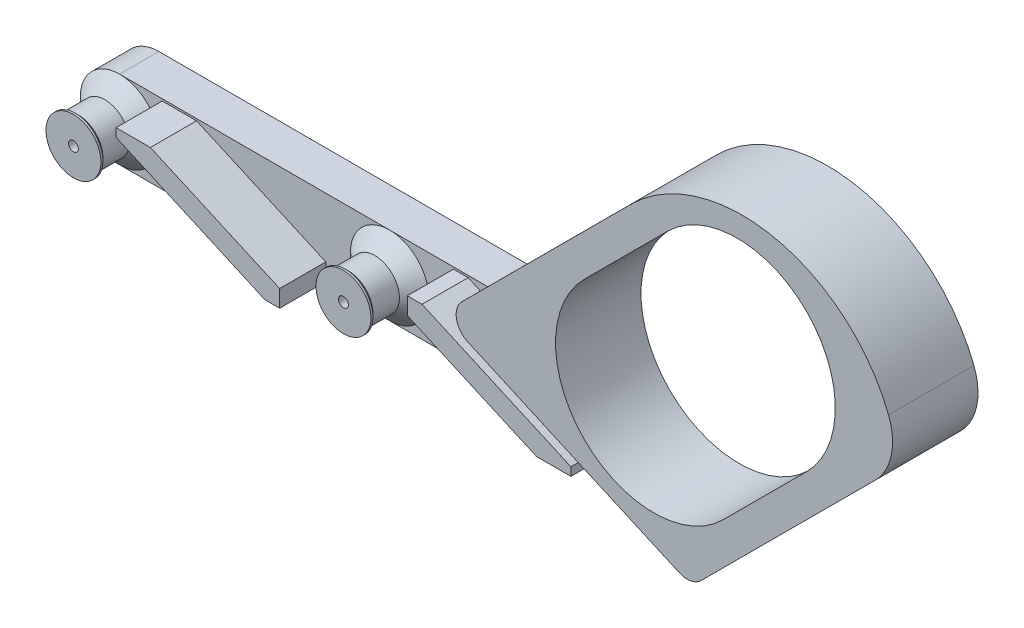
SolidWorks part; units mm, degrees
ref_plane "Alzado" through (0, 0, 0) normal (0, 0, 1) x (1, 0, 0)
ref_plane "Planta" through (0, 0, 0) normal (0, 1, 0) x (1, 0, 0)
ref_plane "Vista lateral" through (0, 0, 0) normal (1, 0, 0) x (0, 0, -1)
sketch "Sketch1" plane through (0, 0, 0) normal (0, 0, 1) x (1, 0, 0)
  line L0 (-27.5, 0) -> (27.5, 0) construction
  line L1 (-27.5, 4) -> (27.5, 4)
  line L2 (-27.5, -4) -> (27.5, -4)
  arc A0 (-27.5, 4) -> (-27.5, -4) centre (-27.5, 0) ccw
  arc A1 (27.5, -4) -> (27.5, 4) centre (27.5, 0) ccw
  point P3 (0, 0)
extrude "Boss-Extrude1" add sketch "Sketch1" along normal blind 4
sketch "Sketch2" plane through (0, 0, 4) normal (0, 0, 1) x (1, 0, 0)
  circle A0 centre (-27.5, 0) radius 4
extrude "Boss-Extrude2" add sketch "Sketch2" along normal blind 1.5
chamfer "Chamfer1" distance 1.5 angle 45 1 edges at (-23.5, 0, 5.5)
sketch "Sketch3" plane through (0, 0, 5.5) normal (0, 0, 1) x (1, 0, 0)
  circle A0 centre (-27.5, 0) radius 2.5
  circle A1 centre (-27.5, 0) radius 2.5 construction
extrude "Boss-Extrude3" add sketch "Sketch3" along normal blind 2
sketch "Sketch4" plane through (0, 0, 7.5) normal (0, 0, 1) x (1, 0, 0)
  circle A0 centre (-27.5, 0) radius 2.8
  circle A1 centre (-27.5, 0) radius 2.5 construction
extrude "Boss-Extrude4" add sketch "Sketch4" along normal blind 1.2
chamfer "Chamfer2" distance 1 angle 45 1 edges at (-24.7, 0, 7.5)
mirror "Mirror5" about plane through (0, 0, 0) normal (1, 0, 0) of "Boss-Extrude4", "Boss-Extrude3", "Boss-Extrude2"
chamfer "Chamfer3" distance 1.5 angle 45 1 edges at (23.5, 0, 5.5)
chamfer "Chamfer4" distance 1 angle 45 1 edges at (24.7, 0, 7.5)
ref_plane "Plane1" through (-13.75, 0, 0) normal (1, 0, 0) x (0, 0, -1)
mirror "Mirror6" about plane through (-13.75, 0, 0) normal (1, 0, 0) of "Boss-Extrude4", "Boss-Extrude3", "Boss-Extrude2"
chamfer "Chamfer5" distance 1 angle 45 1 edges at (-2.8, 0, 7.5)
chamfer "Chamfer6" distance 1.5 angle 45 1 edges at (-4, 0, 5.5)
sketch "Sketch5" plane through (0, 0, 0) normal (0, 0, -1) x (-1, 0, 0)
  circle A0 centre (-27.5, 0) radius 0.5
  circle A1 centre (0, 0) radius 0.5
  circle A2 centre (27.5, 0) radius 0.5
extrude "Cut-Extrude2" cut sketch "Sketch5" against normal blind 9.5
sketch "Sketch6" plane through (0, 0, 4) normal (0, 0, 1) x (1, 0, 0)
  line L2 (-6.5, -3.8) -> (-6.5, -2.0596)
  line L3 (-6.5, -2.0596) -> (-19.661, 3.8)
  line L5 (-19.661, 3.8) -> (-23.161, 3.8)
  line L6 (-23.161, 3.8) -> (-23.161, 2.9501)
  line L7 (-23.161, 2.9501) -> (-8, -3.8)
  line L8 (-8, -3.8) -> (-6.5, -3.8)
  line L9 (-27.5, -4) -> (0, -4) construction
  line L10 (0, 4) -> (-27.5, 4) construction
  dimension "D1" = 156
  dimension "D2" = 2.2
  dimension "D3" = 0.2
  dimension "D4" = 0.2
  dimension "D5" = 3.5
  dimension "D6" = 1.5
  dimension "D7" = 6.5
extrude "Boss-Extrude5" add sketch "Sketch6" along normal up to surface (4.7 mm away)
mirror "Mirror7" about plane through (0, 0, 0) normal (0, 1, 0) of "Boss-Extrude5"
sketch "Sketch7" plane through (0, 0, 8.7) normal (0, 0, 1) x (1, 0, 0)
  line L0 (-14.8544, 1.66) -> (-8.3443, -1.2385)
  line L1 (-13.8305, 1.2041) -> (-19.661, 3.8) construction
  line L2 (-6.5, -2.0596) -> (-11.126, 0) construction
  line L3 (-8.3443, -1.2385) -> (-4.9598, 1.7717)
  line L4 (-4.9598, 1.7717) -> (-5.6268, 5.2784)
  line L5 (-5.6268, 5.2784) -> (-14.8544, 1.66)
  line L6 (-17.0737, 0.2399) -> (-11.6017, -2.1964)
  line L7 (-23.161, 2.9501) -> (-16.5349, 0) construction
  line L8 (-13.8305, -1.2041) -> (-8, -3.8) construction
  line L9 (-11.6017, -2.1964) -> (-20.9225, -7.7318)
  line L10 (-20.9225, -7.7318) -> (-24.559, -3.6433)
  line L11 (-24.559, -3.6433) -> (-22.1459, -0.5196)
  line L12 (-22.1459, -0.5196) -> (-17.0737, 0.2399)
  line L13 (8.9056, 0.9886) -> (14.8337, -1.6507)
  line L14 (6.5, 2.0596) -> (11.126, 0) construction
  line L15 (13.8305, -1.2041) -> (19.661, -3.8) construction
  line L16 (14.8337, -1.6507) -> (7.5401, -4.9541)
  line L17 (7.5401, -4.9541) -> (5.0997, -4.3744)
  line L18 (5.0997, -4.3744) -> (5.0353, -0.6172)
  line L19 (5.0353, -0.6172) -> (8.9056, 0.9886)
  line L20 (11.9995, 2.0193) -> (18.9185, -1.0612)
  line L21 (13.8305, 1.2041) -> (8, 3.8) construction
  line L22 (23.161, -2.9501) -> (16.5349, 0) construction
  line L23 (18.9185, -1.0612) -> (24.031, 3.232)
  line L24 (24.031, 3.232) -> (23.4042, 6.2356)
  line L25 (23.4042, 6.2356) -> (16.1646, 4.7249)
  line L26 (16.1646, 4.7249) -> (11.9995, 2.0193)
extrude "Cut-Extrude5" cut sketch "Sketch7" against normal up to surface (4.7 mm away)
sketch "Sketch8" plane through (0, 0, 0) normal (0, 0, 1) x (1, 0, 0)
  line L0 (-12.0591, 6.0547) -> (-29.3018, 23.2859)
  line L1 (-36.4172, -6.3607) -> (-54.1634, 11.3736)
  line L2 (5.6894, 0) -> (-5.6894, 0) construction
  line L3 (-12.6594, 2.8129) -> (-34.19, -6.7731)
  line L4 (-31.5992, 7.2031) -> (-40.0873, 15.6856) construction
  line L5 (-38.6679, 0.1297) -> (-47.156, 8.6122)
  line L6 (-24.5305, 14.2765) -> (-33.0186, 22.759)
  line L7 (0, 4) -> (-27.5, 4) construction
  line L8 (-14.2588, 2.1008) -> (-11.3144, 3.4117) construction
  line L9 (8.368, -14.3588) -> (-28.368, 22.3527) construction
  line L10 (0, 1.338) -> (0, -1.3728) construction
  arc A0 (-29.3018, 23.2859) -> (-55.5084, 17.8072) centre (-40.6118, 11.9685) ccw
  arc A1 (-12.0591, 6.0547) -> (-12.6594, 2.8129) centre (-13.4729, 4.64) cw
  arc A2 (-38.6679, 0.1297) -> (-24.5305, 14.2765) centre (-31.5992, 7.2031) ccw
  arc A3 (-33.0186, 22.759) -> (-47.156, 8.6122) centre (-40.0873, 15.6856) ccw
  arc A4 (-36.4172, -6.3607) -> (-34.19, -6.7731) centre (-35.0035, -4.946) ccw
  arc A5 (-55.5084, 17.8072) -> (-54.1634, 11.3736) centre (-49.9221, 15.6177) ccw
  point P2 (-35.8432, 11.4443)
  point P27 (-11.1253, -0.8634)
  point P30 (-10, 3.9969)
  dimension "D1" = 2
  dimension "D2" = 16
  dimension "D5" = 2
  dimension "D6" = 6
  dimension "D3" = 20
  dimension "D4" = 12
  dimension "D7" = 3
  dimension "D8" = 3
  dimension "D9" = 24
  dimension "D10" = 10
  dimension "D11" = 34.19
  dimension "D12" = 4.64
extrude "Boss-Extrude6" add sketch "Sketch8" against normal blind 10
mirror "Mirror8" about plane through (0, 0, 0) normal (1, 0, 0) of "Boss-Extrude6"
sketch "Sketch9" plane through (0, 0, 0) normal (0, 0, -1) x (-1, 0, 0)
  line L0 (12.0591, 6.0547) -> (29.3018, 23.2859)
  line L1 (12.6594, 2.8129) -> (34.19, -6.7731)
  line L2 (36.4172, -6.3607) -> (54.1634, 11.3736)
  arc A0 (55.5084, 17.8072) -> (29.3018, 23.2859) centre (40.6118, 11.9685) ccw
  arc A1 (55.5084, 17.8072) -> (29.3018, 23.2859) centre (40.6118, 11.9685) ccw construction
  arc A2 (12.0591, 6.0547) -> (12.6594, 2.8129) centre (13.4729, 4.64) ccw
  arc A3 (12.0591, 6.0547) -> (12.6594, 2.8129) centre (13.4729, 4.64) ccw construction
  arc A6 (34.19, -6.7731) -> (36.4172, -6.3607) centre (35.0035, -4.946) ccw
  arc A7 (34.19, -6.7731) -> (36.4172, -6.3607) centre (35.0035, -4.946) ccw construction
  arc A8 (54.1634, 11.3736) -> (55.5084, 17.8072) centre (49.9221, 15.6177) ccw
  arc A9 (54.1634, 11.3736) -> (55.5084, 17.8072) centre (49.9221, 15.6177) ccw construction
extrude "Cut-Extrude6" cut sketch "Sketch9" along normal up to surface (10 mm away)
sketch "Sketch10" plane through (0, 0, 0) normal (0, 0, 1) x (1, 0, 0)
  line L0 (24.5305, 14.2765) -> (33.0186, 22.759)
  line L1 (38.6679, 0.1297) -> (47.156, 8.6122)
  line L2 (12.0591, 6.0547) -> (29.3018, 23.2859)
  line L3 (34.19, -6.7731) -> (12.6594, 2.8129)
  line L4 (36.4172, -6.3607) -> (54.1634, 11.3736)
  arc A0 (24.5305, 14.2765) -> (38.6679, 0.1297) centre (31.5992, 7.2031) ccw
  arc A1 (47.156, 8.6122) -> (33.0186, 22.759) centre (40.0873, 15.6856) ccw
  arc A2 (47.156, 8.6122) -> (33.0186, 22.759) centre (40.0873, 15.6856) ccw construction
  arc A3 (24.5305, 14.2765) -> (22.1261, 4) centre (31.5992, 7.2031) ccw construction
  arc A4 (12.0591, 6.0547) -> (12.6594, 2.8129) centre (13.4729, 4.64) ccw
  arc A5 (12.0591, 6.0547) -> (11.578, 4) centre (13.4729, 4.64) ccw construction
  arc A10 (55.5084, 17.8072) -> (29.3018, 23.2859) centre (40.6118, 11.9685) ccw
  arc A11 (34.19, -6.7731) -> (36.4172, -6.3607) centre (35.0035, -4.946) ccw
  arc A12 (54.1634, 11.3736) -> (55.5084, 17.8072) centre (49.9221, 15.6177) ccw
  arc A13 (54.1634, 11.3736) -> (55.5084, 17.8072) centre (49.9221, 15.6177) ccw construction
extrude "Boss-Extrude7" add sketch "Sketch10" along normal up to surface (8.7 mm away)
sketch "Sketch11" plane through (0, 0, -10) normal (0, 0, -1) x (-1, 0, 0)
  line L0 (-54.1634, 11.3736) -> (-36.4172, -6.3607)
  line L1 (-34.19, -6.7731) -> (-12.6594, 2.8129)
  line L2 (-29.3018, 23.2859) -> (-12.0591, 6.0547)
  arc A0 (-29.3018, 23.2859) -> (-55.5084, 17.8072) centre (-40.6118, 11.9685) ccw
  arc A1 (-29.3018, 23.2859) -> (-55.5084, 17.8072) centre (-40.6118, 11.9685) ccw construction
  arc A2 (-55.5084, 17.8072) -> (-54.1634, 11.3736) centre (-49.9221, 15.6177) ccw
  arc A3 (-55.5084, 17.8072) -> (-54.1634, 11.3736) centre (-49.9221, 15.6177) ccw construction
  arc A4 (-36.4172, -6.3607) -> (-34.19, -6.7731) centre (-35.0035, -4.946) ccw
  arc A5 (-36.4172, -6.3607) -> (-34.19, -6.7731) centre (-35.0035, -4.946) ccw construction
  arc A6 (-12.6594, 2.8129) -> (-12.0591, 6.0547) centre (-13.4729, 4.64) ccw
  arc A7 (-12.6594, 2.8129) -> (-12.0591, 6.0547) centre (-13.4729, 4.64) ccw construction
extrude "Cut-Extrude7" cut sketch "Sketch11" against normal up to surface (10 mm away)
sketch "Sketch12" plane through (0, 0, 0) normal (0, 0, -1) x (-1, 0, 0)
  circle A0 centre (-31.5992, 7.2031) radius 10
  arc A1 (-22.1261, 4) -> (-24.5305, 14.2765) centre (-31.5992, 7.2031) ccw construction
extrude "Cut-Extrude8" cut sketch "Sketch12" against normal up to surface (8.7 mm away)
sketch "Sketch13" plane through (0, 0, 8.7) normal (0, 0, 1) x (1, 0, 0)
  line L0 (23.9667, -2.2214) -> (28.0998, -4.0616)
  line L1 (12.6594, 2.8129) -> (34.19, -6.7731) construction
  line L2 (28.0998, -4.0616) -> (25.824, -4.335)
  line L3 (25.824, -4.335) -> (23.9667, -2.2214)
extrude "Cut-Extrude9" cut sketch "Sketch13" against normal up to surface (4.7 mm away)
equation "\"largo\"= 55"
equation "\"D1@Sketch1\"=\"largo\""
equation "\"ancho\"= 8"
equation "\"D2@Sketch1\"=\"ancho\""
equation "\"thick\"= 4"
equation "\"D1@Boss-Extrude1\"=\"thick\""
equation "\"D1@Sketch2\"=\"largo\"/2"
equation "\"thick_c\"= 1.5"
equation "\"c\"= 8"
equation "\"c1\"= 5.6"
equation "\"D2@Sketch2\"=\"c\""
equation "\"D1@Boss-Extrude2\"=\"thick_c\""
equation "\"alto_c\"= 2"
equation "\"D1@Boss-Extrude3\"=\"alto_c\""
equation "\"D1@Sketch4\"=\"c1\""
equation "\"c_mini\"= 1"
equation "\"D1@Sketch5\"=\"c_mini\""
equation "\"D2@Sketch5\"=\"largo\"/2"
equation "\"D3@Sketch5\"=\"c_mini\""
equation "\"D4@Sketch5\"=\"c_mini\""
equation "\"chan_1\"= 1.5"
equation "\"chan_2\"= 1"
equation "\"D1@Chamfer1\"=\"chan_1\""
equation "\"D1@Chamfer3\"=\"chan_1\""
equation "\"D1@Chamfer6\"=\"chan_1\""
